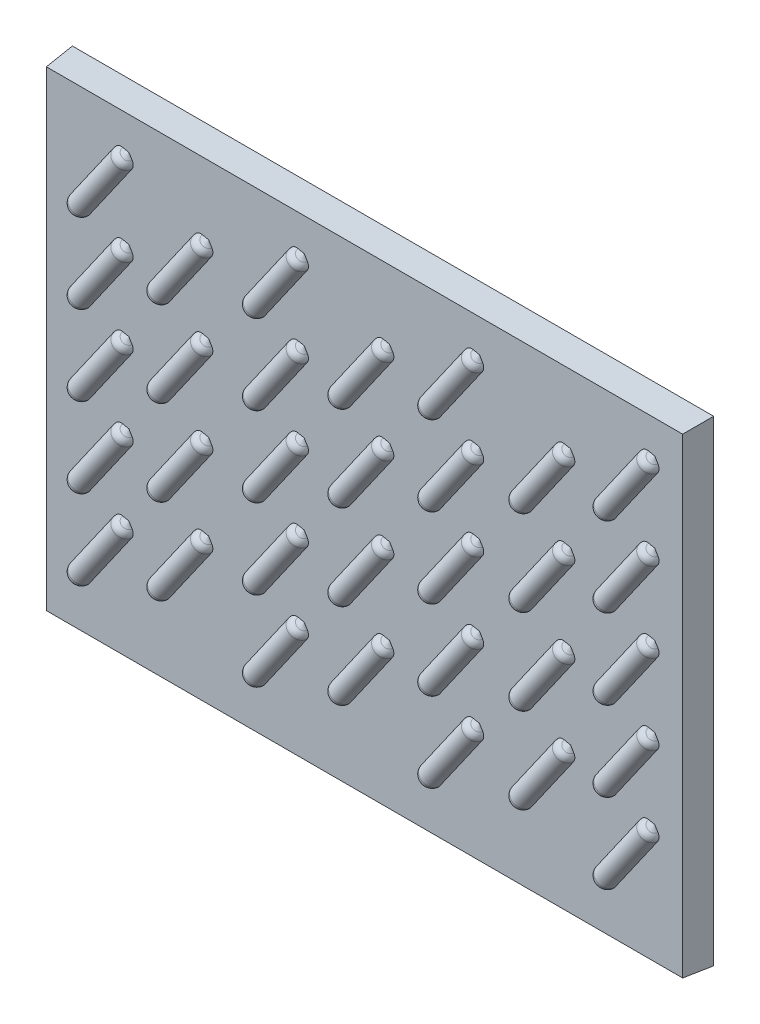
SolidWorks part; units mm, degrees
ref_plane "Plan de face" through (0, 0, 0) normal (0, 0, 1) x (1, 0, 0)
ref_plane "Plan de dessus" through (0, 0, 0) normal (0, 1, 0) x (1, 0, 0)
ref_plane "Plan de droite" through (0, 0, 0) normal (1, 0, 0) x (0, 0, -1)
sketch "Esquisse1" plane through (0, 0, 0) normal (0, 0, 1) x (1, 0, 0)
  line L1 (-22.5, 16.7) -> (22.5, 16.7)
  line L2 (-22.5, 16.7) -> (-22.5, -16.7)
  line L3 (-22.5, -16.7) -> (22.5, -16.7)
  line L4 (22.5, 16.7) -> (22.5, -16.7)
  line L5 (-22.5, 16.7) -> (22.5, -16.7) construction
  line L6 (-22.5, -16.7) -> (22.5, 16.7) construction
  point P0 (0, 0)
  dimension "D1" = 45
  dimension "D2" = 33.4
extrude "Boss.-Extru.1" add sketch "Esquisse1" along normal blind 2
sketch "Esquisse2" plane through (0, -16.7, 0) normal (0, -1, 0) x (1, 0, 0)
  line L0 (-22.5, 2) -> (22.5, 2) construction
  line L1 (-23.5, 2) -> (-21.5, 2)
  ellipse E0 centre (-22.5, 2) end of major axis (-21.5, 2) minor radius 0.2
  dimension "D1" = 1
  dimension "D2" = 0.2
ref_plane "Plan3" through (-7.2513, 5.0774, 0) normal (-0.8192, 0.5736, 0) x (0, 0, 1)
sketch "Esquisse8" plane through (-7.2513, 5.0774, 0) normal (-0.8192, 0.5736, 0) x (0, 0, 1)
  line L0 (2, -22.6853) -> (2, -16.1853) construction
  line L1 (2, -26.5853) -> (2, -22.6853) construction
  line L2 (2, -22.6853) -> (2, -16.1853)
  line L3 (2, -22.6853) -> (1.603, -22.5152)
  line L4 (1.3, -22.0556) -> (1.3, -16.815)
  line L5 (1.603, -16.3554) -> (2, -16.1853)
  arc A0 (1.603, -16.3554) -> (1.3, -16.815) centre (1.8, -16.815) ccw
  arc A1 (1.3, -22.0556) -> (1.603, -22.5152) centre (1.8, -22.0556) ccw
  point P4 (1.3, -16.4853)
  point P10 (1.3, -22.3853)
  dimension "D6" = 0.5
  dimension "D1" = 0.7
  dimension "D2" = 6.5
  dimension "D3" = 3.9
  dimension "D4" = 0.3
  dimension "D5" = 0.3
revolve "Révolution4" add sketch "Esquisse8" angle 360 about L0
pattern_linear "Répétition linéaire2" count 5 spacing 5.6 along (0, 1, 0) of "Révolution4"
pattern_linear "Répétition linéaire3" count 4 spacing 12.3 along (1, 0, 0) of "Répétition linéaire2", "Révolution4"
ref_plane "Plan8" through (-4.3843, 3.0699, 0) normal (-0.8192, 0.5736, 0) x (0, 0, 1)
sketch "Esquisse11" plane through (-4.3843, 3.0699, 0) normal (-0.8192, 0.5736, 0) x (0, 0, 1)
  line L0 (2, -17.9346) -> (2, -11.4346) construction
  line L1 (2, -24.1346) -> (2, -17.9346) construction
  line L2 (2, -17.9346) -> (2, -11.4346)
  line L3 (2, -17.9346) -> (1.603, -17.7645)
  line L4 (1.3, -17.3049) -> (1.3, -12.0643)
  line L5 (1.603, -11.6047) -> (2, -11.4346)
  line L7 (2, -26.5853) -> (2, -0.7744) construction
  arc A0 (1.603, -11.6047) -> (1.3, -12.0643) centre (1.8, -12.0643) ccw
  arc A1 (1.3, -17.3049) -> (1.603, -17.7645) centre (1.8, -17.3049) ccw
  point P4 (1.3, -11.7346)
  point P10 (1.3, -17.6346)
  dimension "D6" = 0.5
  dimension "D1" = 0.7
  dimension "D2" = 6.5
  dimension "D3" = 6.2
  dimension "D4" = 0.3
  dimension "D5" = 0.3
revolve "Révolution5" add sketch "Esquisse11" angle 360 about L2
pattern_linear "Répétition linéaire4" count 4 spacing 6 along (0, 1, 0) of "Révolution5"
pattern_linear "Répétition linéaire5" count 3 spacing 12.7 along (1, 0, 0) of "Répétition linéaire4", "Révolution5"
sketch "Esquisse13" plane through (0, 0, 0) normal (0, 1, 0) x (1, 0, 0)
  line L0 (22.5, 0) -> (27.5, 0)
  line L1 (27.5, 0) -> (27.5, -1.5)
  line L2 (27.5, -1.5) -> (23, -1.5)
  line L3 (23, -1.5) -> (22.5, -1)
  line L4 (22.5, -2) -> (22.5, 0) construction
  line L5 (22.5, -1) -> (22.5, 0)
  line L6 (19.2797, 0) -> (28.8841, 0) construction
  line L7 (-22.5, 0) -> (22.5, 0) construction
  dimension "D1" = 5
  dimension "D2" = 45
  dimension "D3" = 1.5
revolve "Révolution6" [suppressed] add sketch "Esquisse13" angle 90 about L6
draft "Dépouille1" type of draft neutral plane draft angle 5 faces to draft 4 parameters "D1"=5
